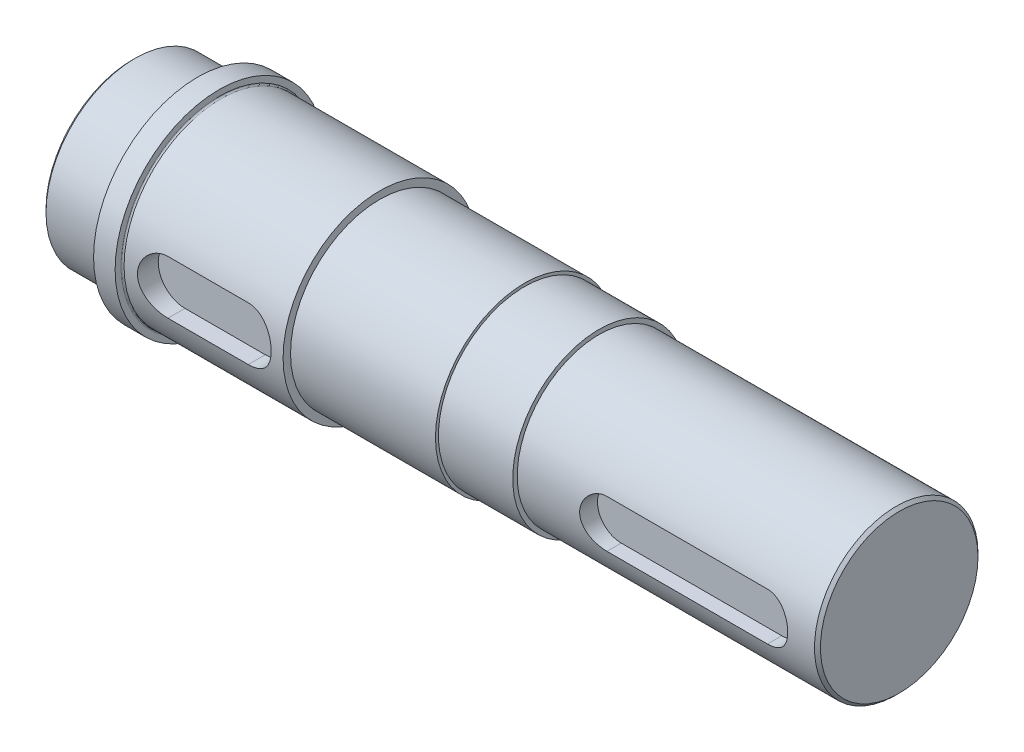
SolidWorks part; units mm, degrees
ref_plane "Спереди" through (0, 0, 0) normal (0, 0, 1) x (1, 0, 0)
ref_plane "Сверху" through (0, 0, 0) normal (0, 1, 0) x (1, 0, 0)
ref_plane "Справа" through (0, 0, 0) normal (1, 0, 0) x (0, 0, -1)
sketch "Sketch1" plane through (0, 0, 0) normal (0, 0, 1) x (1, 0, 0)
  line L0 (277.0936, 0) -> (-15.1757, 0) construction
  line L1 (0, 0) -> (0, 30)
  line L2 (0, 30) -> (22, 30)
  line L3 (22, 30) -> (22, 35)
  line L4 (22, 35) -> (29.25, 35)
  line L5 (29.25, 35) -> (29.25, 32.5)
  line L6 (29.25, 32.5) -> (83.25, 32.5)
  line L7 (83.25, 32.5) -> (83.25, 30)
  line L8 (83.25, 30) -> (132, 30)
  line L9 (132, 30) -> (132, 29)
  line L10 (132, 29) -> (157, 29)
  line L11 (157, 29) -> (157, 27.5)
  line L12 (157, 27.5) -> (258, 27.5)
  line L13 (258, 27.5) -> (258, 0)
  line L14 (258, 0) -> (0, 0)
  dimension "D1" = 55
  dimension "D2" = 58
  dimension "D3" = 60
  dimension "D4" = 65
  dimension "D5" = 70
  dimension "D6" = 60
  dimension "D7" = 22
  dimension "D8" = 7.25
  dimension "D9" = 54
  dimension "D10" = 258
  dimension "D11" = 135
  dimension "D12" = 110
revolve "Revolve1" add sketch "Sketch1" angle 360 about L0
chamfer "Chamfer1" distance 1 angle 45 2 edges at (258, 0, -27.5) (0, 0, -30)
ref_plane "Plane1" through (0, 0, 27.5) normal (0, 0, 1) x (1, 0, 0)
sketch "Sketch2" plane through (0, 0, 27.5) normal (0, 0, 1) x (1, 0, 0)
  line L0 (301.6441, 0) -> (-48.3101, 0) construction
  line L1 (240, 8) -> (186, 8)
  line L2 (186, -8) -> (240, -8)
  line L4 (258, -26.5) -> (258, 26.5) construction
  arc A0 (186, 8) -> (186, -8) centre (186, 0) ccw
  arc A1 (240, -8) -> (240, 8) centre (240, 0) ccw
  point P4 (178, 0)
  point P6 (248, 0)
  dimension "D2" = 8
  dimension "D3" = 70
  dimension "D1" = 10
extrude "Cut-Extrude1" cut sketch "Sketch2" against normal blind 6
ref_plane "Plane2" through (0, 0, 32.5) normal (0, 0, 1) x (1, 0, 0)
sketch "Sketch3" plane through (0, 0, 32.5) normal (0, 0, 1) x (1, 0, 0)
  line L0 (-53.7004, 0) -> (337.1136, 0) construction
  line L1 (70.25, 9) -> (43.25, 9)
  line L2 (70.25, -9) -> (43.25, -9)
  line L3 (29.25, -35) -> (29.25, 35) construction
  arc A0 (43.25, 9) -> (43.25, -9) centre (43.25, 0) ccw
  arc A1 (70.25, -9) -> (70.25, 9) centre (70.25, 0) ccw
  point P4 (34.25, 0)
  point P6 (79.25, 0)
  dimension "D1" = 9
  dimension "D2" = 5
  dimension "D3" = 45
extrude "Cut-Extrude2" cut sketch "Sketch3" against normal blind 7
sketch "Sketch4" plane through (0, 0, 0) normal (0, 0, 1) x (1, 0, 0)
  line L0 (22, 30) -> (22, 29)
  line L1 (22, 35) -> (22, -35) construction
  line L2 (22, 29) -> (20, 29)
  line L3 (20, 29) -> (19, 30)
  line L4 (22, 30) -> (1, 30) construction
  line L5 (19, 30) -> (22, 30)
  line L6 (304.7172, 0) -> (-38.9237, 0) construction
  dimension "D1" = 1
  dimension "D2" = 45
  dimension "D3" = 2
revolve "Cut-Revolve1" cut sketch "Sketch4" angle 360 about L6
fillet "Fillet1" radius 0.5 1 edges at (29.25, 0, -32.5)
